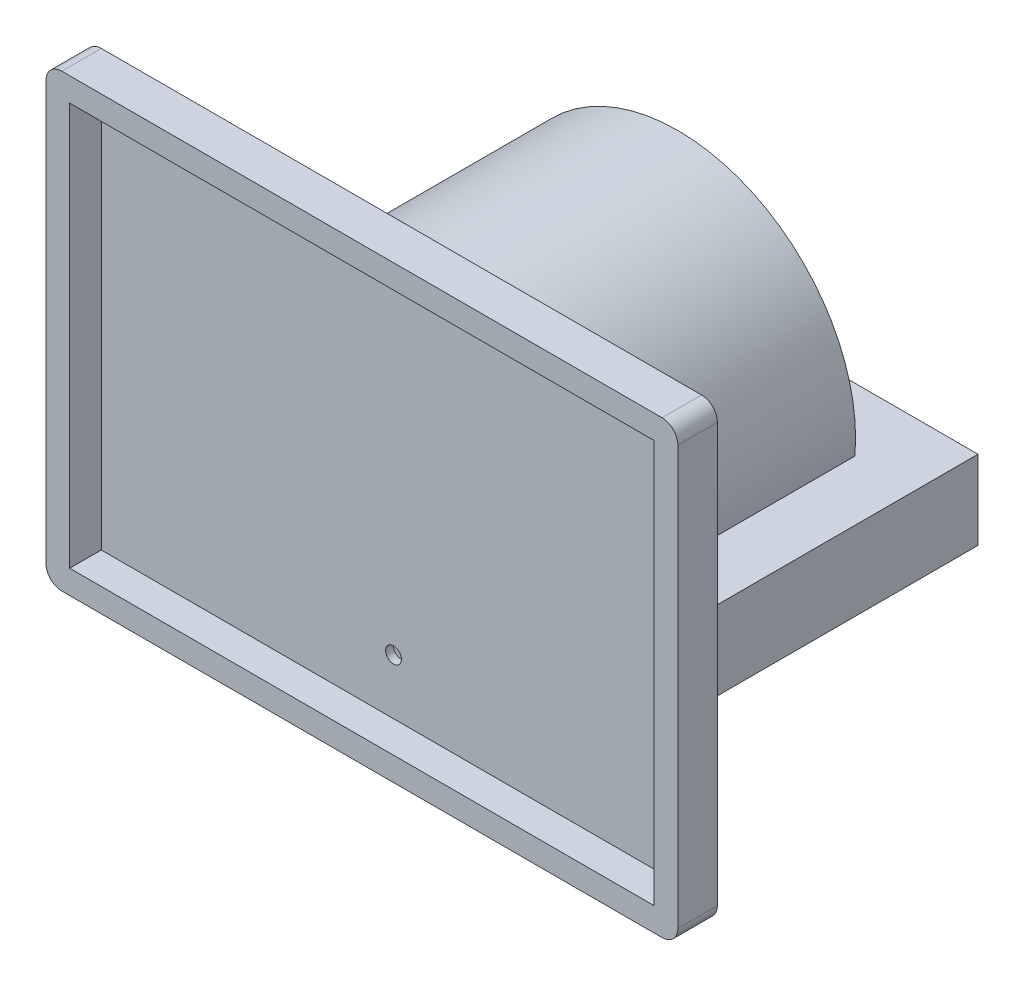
SolidWorks part; units mm, degrees
ref_plane "Plan de face" through (0, 0, 0) normal (0, 0, 1) x (1, 0, 0)
ref_plane "Plan de dessus" through (0, 0, 0) normal (0, 1, 0) x (1, 0, 0)
ref_plane "Plan de droite" through (0, 0, 0) normal (1, 0, 0) x (0, 0, -1)
sketch "Esquisse1" plane through (0, 0, 0) normal (0, 0, 1) x (1, 0, 0)
  line L1 (-80, 57) -> (0, 57)
  line L2 (-80, 57) -> (-80, 0)
  line L3 (-80, 0) -> (0, 0)
  line L4 (0, 57) -> (0, 0)
  dimension "D1" = 80
  dimension "D2" = 57
extrude "Boss.-Extru.1" add sketch "Esquisse1" along normal blind 5
sketch "Esquisse2" plane through (0, 0, 5) normal (0, 0, 1) x (1, 0, 0)
  line L0 (-80, 0) -> (0, 0) construction
  line L1 (-77, 54) -> (-3, 54)
  line L2 (-77, 54) -> (-77, 3)
  line L3 (-77, 3) -> (-3, 3)
  line L4 (-3, 54) -> (-3, 3)
  line L5 (-80, 57) -> (-80, 0) construction
  line L6 (0, 57) -> (-80, 57) construction
  line L7 (0, 0) -> (0, 57) construction
  dimension "D1" = 3
  dimension "D2" = 3
  dimension "D3" = 3
  dimension "D4" = 3
extrude "Enlèv. mat.-Extru.1" cut sketch "Esquisse2" against normal blind 4
sketch "Esquisse3" plane through (0, 0, 1) normal (0, 0, 1) x (1, 0, 0)
  line L0 (-90.5417, 10) -> (8.3336, 10) construction
  line L1 (-40, 60.9268) -> (-40, -5.8896) construction
  line L2 (-80, 57) -> (-80, 0) construction
  line L3 (-80, 0) -> (0, 0) construction
  circle A0 centre (-40, 10) radius 1
  dimension "D3" = 2
  dimension "D1" = 40
  dimension "D2" = 10
  dimension "D4" = 40
extrude "Enlèv. mat.-Extru.2" cut sketch "Esquisse3" against normal through all
sketch "Esquisse4" plane through (0, 0, 0) normal (0, 0, -1) x (-1, 0, 0)
  line L0 (0, 0) -> (0, 57) construction
  line L1 (0, 57) -> (80, 57) construction
  circle A0 centre (40, 27) radius 22.5
  dimension "D1" = 40
  dimension "D3" = 45
  dimension "D2" = 30
extrude "Boss.-Extru.2" add sketch "Esquisse4" along normal blind 35
sketch "Esquisse5" plane through (0, 0, -35) normal (0, 0, -1) x (-1, 0, 0)
  line L0 (80, 0) -> (0, 0) construction
  line L1 (10, 25) -> (70, 25)
  line L2 (10, 25) -> (10, 15)
  line L3 (10, 15) -> (70, 15)
  line L4 (70, 25) -> (70, 15)
  line L5 (0, 0) -> (0, 57) construction
  line L6 (80, 57) -> (80, 0) construction
  dimension "D1" = 10
  dimension "D2" = 15
  dimension "D3" = 10
  dimension "D4" = 10
extrude "Boss.-Extru.3" add sketch "Esquisse5" against normal blind 35 separate body
sketch "Esquisse6" plane through (0, 0, -35) normal (0, 0, -1) x (-1, 0, 0)
  line L0 (70, 25) -> (10, 25) construction
  line L1 (10, 25) -> (70, 25)
  line L2 (10, 25) -> (10, 15)
  line L3 (10, 15) -> (70, 15)
  line L4 (70, 25) -> (70, 15)
  line L5 (10, 25) -> (10, 15) construction
  line L6 (80, 0) -> (0, 0) construction
  line L7 (80, 57) -> (80, 0) construction
  dimension "D1" = 15
  dimension "D2" = 10
extrude "Boss.-Extru.4" add sketch "Esquisse6" along normal blind 8
sketch "Esquisse7" plane through (0, 0, -35) normal (0, 0, -1) x (-1, 0, 0)
  line L0 (62.4109, 25) -> (17.5891, 25) construction
  line L1 (30, 30) -> (35, 30)
  line L2 (30, 30) -> (30, 25)
  line L3 (30, 25) -> (35, 25)
  line L4 (35, 30) -> (35, 25)
  line L5 (70, 25) -> (10, 25) construction
  line L6 (45, 30) -> (50, 30)
  line L7 (45, 30) -> (45, 25)
  line L8 (45, 25) -> (50, 25)
  line L9 (50, 30) -> (50, 25)
  line L10 (10, 25) -> (10, 15) construction
  line L11 (70, 15) -> (70, 25) construction
  dimension "D1" = 20
  dimension "D2" = 5
  dimension "D3" = 20
  dimension "D4" = 5
  dimension "D5" = 5
  dimension "D6" = 5
extrude "Boss.-Extru.5" add sketch "Esquisse7" along normal blind 6
sketch "Esquisse8" plane through (0, 0, -35) normal (0, 0, -1) x (-1, 0, 0)
  line L0 (26.1003, 27.5) -> (57.0585, 27.5) construction
  line L1 (32.5, 32.5821) -> (32.5, 22.6278) construction
  line L2 (47.5, 32.8076) -> (47.5, 23.2076) construction
  line L3 (30, 30) -> (30, 25) construction
  line L4 (30, 25) -> (17.5891, 25) construction
  line L5 (45, 30) -> (45, 25) construction
  circle A0 centre (32.5, 27.5) radius 1.25
  circle A1 centre (47.5, 27.5) radius 1.25
  dimension "D4" = 2.5
  dimension "D5" = 2.5
  dimension "D1" = 2.5
  dimension "D2" = 2.5
  dimension "D3" = 2.5
extrude "Enlèv. mat.-Extru.3" cut sketch "Esquisse8" along normal blind 6
sketch "Esquisse9" plane through (0, 30, 0) normal (0, 1, 0) x (1, 0, 0)
  line L0 (-55.8247, 38.5) -> (-25.8513, 38.5) construction
  line L1 (-45, 41) -> (-50, 41) construction
  line L2 (-47.5, 42.1743) -> (-47.5, 37.0406) construction
  line L3 (-32.5, 42.1743) -> (-32.5, 36.6395) construction
  line L4 (-50, 41) -> (-50, 35) construction
  line L6 (-35, 41) -> (-35, 35) construction
  circle A0 centre (-47.5, 38.5) radius 1
  circle A1 centre (-32.5, 38.5) radius 1
  dimension "D4" = 2
  dimension "D5" = 2
  dimension "D1" = 2.5
  dimension "D2" = 2.5
  dimension "D3" = 2.5
extrude "Enlèv. mat.-Extru.4" cut sketch "Esquisse9" against normal blind 3
sketch "Esquisse10" plane through (0, 0, 0) normal (0, 0, -1) x (-1, 0, 0)
  line L0 (0, 0) -> (0, 57) construction
  line L1 (8, 51) -> (72, 51)
  line L2 (8, 51) -> (8, 2)
  line L3 (8, 2) -> (72, 2)
  line L4 (72, 51) -> (72, 2)
  line L5 (80, 57) -> (80, 0) construction
  line L6 (0, 57) -> (80, 57) construction
  line L7 (80, 0) -> (0, 0) construction
  dimension "D1" = 8
  dimension "D2" = 8
  dimension "D3" = 6
  dimension "D4" = 2
extrude "Boss.-Extru.6" add sketch "Esquisse10" along normal blind 1
fillet "Congé1" radius 2 4 edges at (-80, 57, 2.5) (-80, 0, 2.5) (0, 0, 2.5) (0, 57, 2.5)
